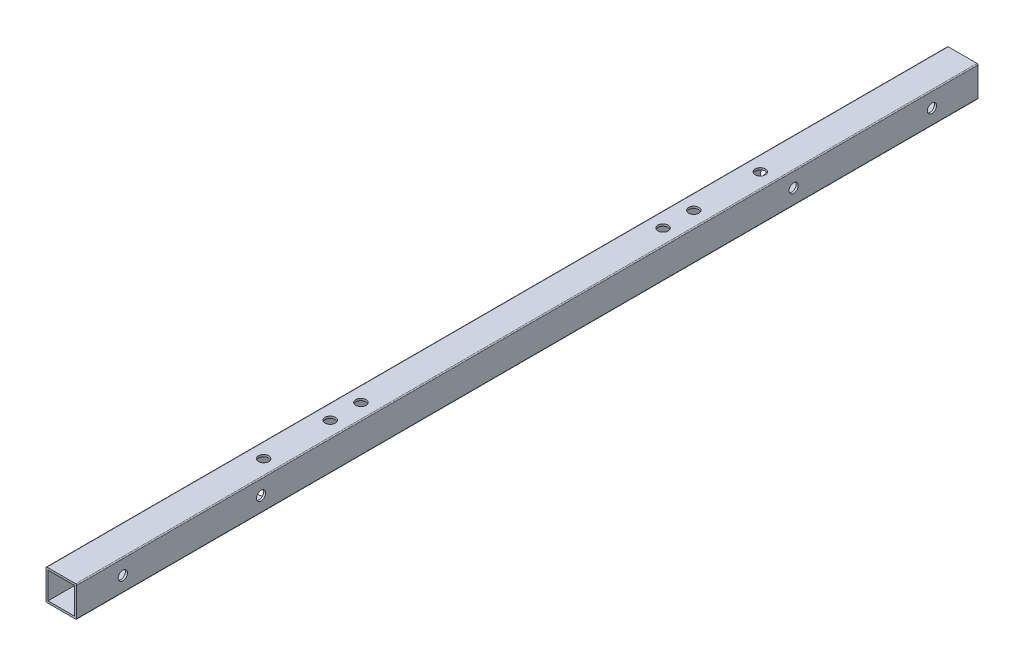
SolidWorks part; units mm, degrees
ref_plane "Plan1" through (0, 0, 0) normal (0, 0, 1) x (1, 0, 0)
ref_plane "Plan2" through (0, 0, 0) normal (0, 1, 0) x (1, 0, 0)
ref_plane "Plan3" through (0, 0, 0) normal (1, 0, 0) x (0, 0, -1)
sketch "Esquisse1" plane through (0, 0, 0) normal (0, 0, 1) x (1, 0, 0)
  line L0 (-14, 15) -> (14, 15)
  line L1 (-15, 14) -> (-15, -14)
  line L2 (14, -15) -> (-14, -15)
  line L3 (15, -14) -> (15, 14)
  line L4 (14, 14) -> (-14, -14) construction
  arc A0 (-14, -15) -> (-15, -14) centre (-14, -14) cw
  arc A1 (-15, 14) -> (-14, 15) centre (-14, 14) cw
  arc A2 (15, 14) -> (14, 15) centre (14, 14) ccw
  arc A3 (15, -14) -> (14, -15) centre (14, -14) cw
  dimension "D1" = 1
  dimension "D2" = 30
extrude "Base-Extru.-Mince" add sketch "Esquisse1" along normal blind 880 thin
sketch "Esquisse2" plane through (0, 15, 0) normal (0, 1, 0) x (-1, 0, 0)
  line L0 (15, 880) -> (15, 0) construction
  circle A0 centre (0, 292.5) radius 5
  circle A1 centre (0, 587.5) radius 5
  circle A2 centre (0, 197.5) radius 5
  circle A3 centre (0, 262.5) radius 5
  circle A4 centre (0, 617.5) radius 5
  circle A5 centre (0, 682.5) radius 5
  dimension "D1" = 10
  dimension "D9" = 10
  dimension "D2" = 15
  dimension "D3" = 295
  dimension "D4" = 292.5
  dimension "D5" = 65
  dimension "D6" = 65
  dimension "D7" = 355
  dimension "D8" = 197.5
extrude "Enlèv. mat.-Extru.1" cut sketch "Esquisse2" against normal blind 35
sketch "Esquisse3" plane through (15, 0, 0) normal (1, 0, 0) x (0, 0, -1)
  line L0 (-880, 15) -> (0, 15) construction
  line L1 (-880, -14) -> (-880, 14) construction
  circle A0 centre (-835, 0) radius 4.5
  circle A1 centre (-700, 0) radius 4.5
  circle A2 centre (-180, 0) radius 4.5
  circle A3 centre (-45, 0) radius 4.5
  dimension "D6" = 9
  dimension "D1" = 15
  dimension "D2" = 135
  dimension "D3" = 45
  dimension "D4" = 135
  dimension "D5" = 45
extrude "Enlèv. mat.-Extru.2" cut sketch "Esquisse3" against normal through all
